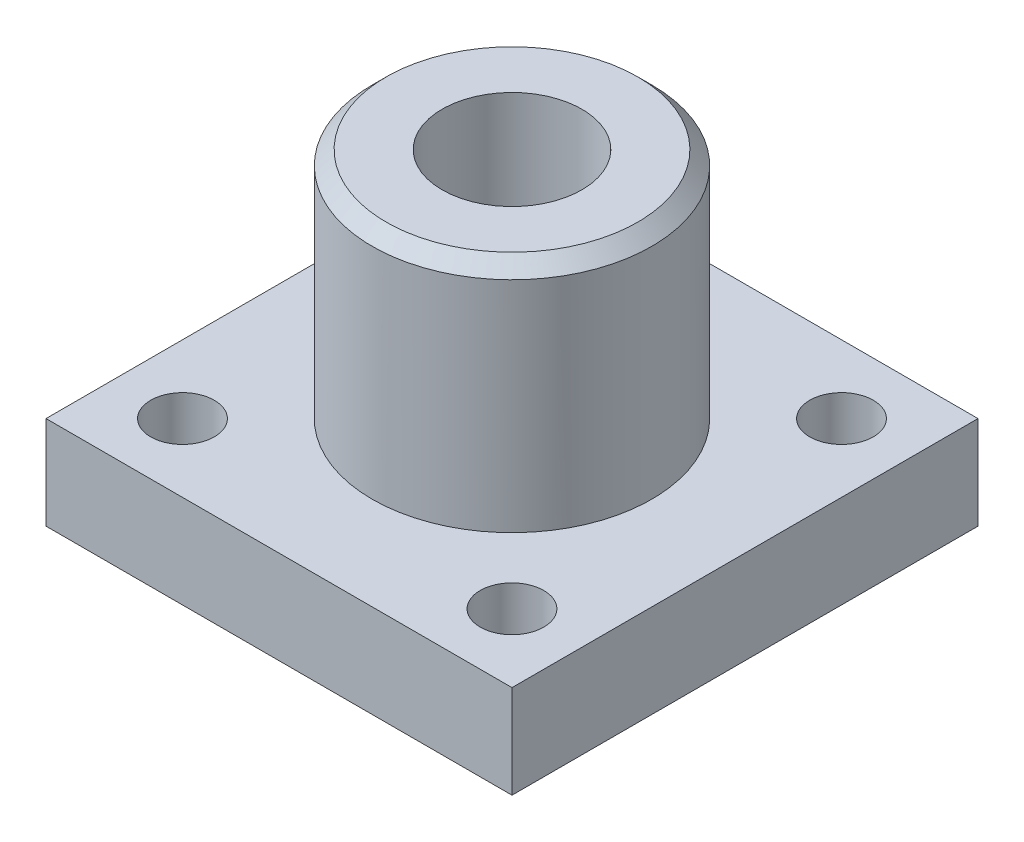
SolidWorks part; units mm, degrees
ref_plane "Front" through (0, 0, 0) normal (0, 0, 1) x (1, 0, 0)
ref_plane "Top" through (0, 0, 0) normal (0, 1, 0) x (1, 0, 0)
ref_plane "Right" through (0, 0, 0) normal (1, 0, 0) x (0, 0, -1)
sketch "Sketch1" plane through (0, 0, 0) normal (0, 1, 0) x (1, 0, 0)
  line L0 (127, -127) -> (-127, 127) construction
  line L1 (-127, 127) -> (127, 127)
  line L2 (-127, 127) -> (-127, -127)
  line L3 (-127, -127) -> (127, -127)
  line L4 (127, 127) -> (127, -127)
  dimension "D1" = 254
extrude "Extrude1" add sketch "Sketch1" along normal blind 50.8
sketch "Sketch2" plane through (0, 50.8, 0) normal (0, 1, 0) x (1, 0, 0)
  line L0 (0, 0) -> (-127, 127) construction
  line L1 (0, 0) -> (127, 127) construction
  line L2 (0, 0) -> (127, -127) construction
  line L3 (0, 0) -> (-127, -127) construction
  circle A0 centre (0, 0) radius 127 construction
  circle A1 centre (89.8026, 89.8026) radius 17.324
  circle A2 centre (-89.8026, 89.8026) radius 17.324
  circle A3 centre (-89.8026, -89.8026) radius 17.324
  circle A4 centre (89.8026, -89.8026) radius 17.324
  dimension "D1" = 254
extrude "Cut-Extrude1" cut sketch "Sketch2" against normal through all
sketch "Sketch3" plane through (0, 50.8, 0) normal (0, 1, 0) x (1, 0, 0)
  circle A0 centre (0, 0) radius 76.2
  dimension "D1" = 152.4
extrude "Extrude2" add sketch "Sketch3" along normal blind 127
chamfer "Chamfer1" distance 7.62 angle 45
sketch "Sketch4" plane through (0, 177.8, 0) normal (0, 1, 0) x (1, 0, 0)
  circle A0 centre (0, 0) radius 38.1
  dimension "D1" = 76.2
extrude "Cut-Extrude2" cut sketch "Sketch4" against normal through all
